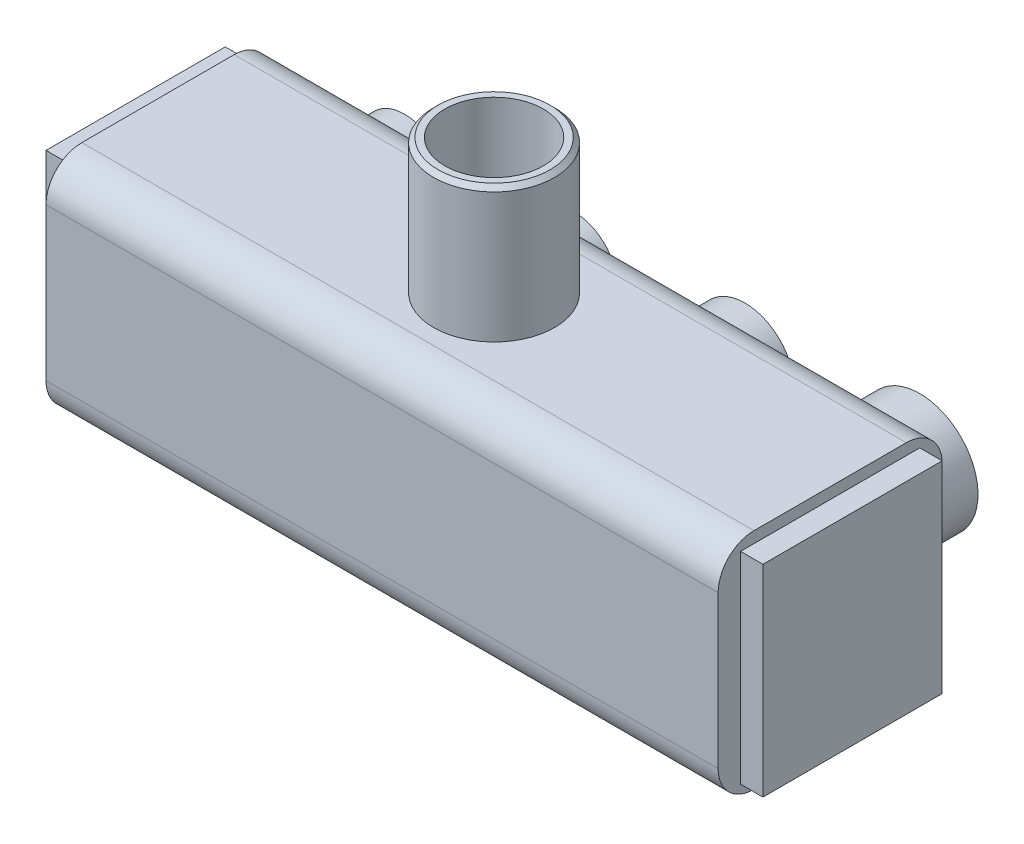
SolidWorks part; units mm, degrees
ref_plane "Plan de face" through (0, 0, 0) normal (0, 0, 1) x (1, 0, 0)
ref_plane "Plan de dessus" through (0, 0, 0) normal (0, 1, 0) x (1, 0, 0)
ref_plane "Plan de droite" through (0, 0, 0) normal (1, 0, 0) x (0, 0, -1)
sketch "Esquisse1" plane through (0, 0, 0) normal (0, 1, 0) x (1, 0, 0)
  line L0 (-75, 0) -> (75, 0)
  dimension "D1" = 150
other "Elément mécano-soudé1"
ref_plane "Plan1" through (-75, 0, 0) normal (1, 0, 0) x (0, 0, -1)
sketch "Sketch1" plane through (-75, 0, 0) normal (1, 0, 0) x (0, 0, -1)
  line L0 (-17, -20) -> (17, -20)
  line L1 (-20, -17) -> (-20, 17)
  line L2 (17, 20) -> (-17, 20)
  line L3 (20, 17) -> (20, -17)
  line L4 (-17, -25) -> (17, -25)
  line L5 (-25, -17) -> (-25, 17)
  line L6 (17, 25) -> (-17, 25)
  line L7 (25, 17) -> (25, -17)
  arc A0 (25, 17) -> (17, 25) centre (17, 17) ccw
  arc A1 (17, -25) -> (25, -17) centre (17, -17) ccw
  arc A2 (-25, -17) -> (-17, -25) centre (-17, -17) ccw
  arc A3 (-17, 25) -> (-25, 17) centre (-17, 17) ccw
  arc A4 (-17, 20) -> (-20, 17) centre (-17, 17) ccw
  arc A5 (20, 17) -> (17, 20) centre (17, 17) ccw
  arc A6 (17, -20) -> (20, -17) centre (17, -17) ccw
  arc A7 (-20, -17) -> (-17, -20) centre (-17, -17) ccw
  point P0 (-25, 0)
  point P1 (25, 0)
  point P2 (0, 25)
  point P3 (0, -25)
  point P4 (0, 0)
  point P5 (-25, -25)
  point P6 (25, -25)
  point P7 (25, 25)
  point P8 (-25, 25)
  point P33 (0, 0)
  dimension "D1" = 8
  dimension "Thickness" = 5
  dimension "V_leg" = 50
sketch "Esquisse3" plane through (75, 0, 0) normal (1, 0, 0) x (0, 0, -1)
  line L0 (0, 22.5) -> (0, -22.5)
  dimension "D1" = 45
other "Elément mécano-soudé2"
ref_plane "Plan2" through (75, 22.5, 0) normal (0, -1, 0) x (1, 0, 0)
sketch "Esquisse11" plane through (80, 22.5, -20) normal (0, -1, 0) x (0, 0, 1)
  line L0 (20, 5) -> (20, 0) construction
  line L1 (0, 0) -> (40, 0)
  line L2 (0, 0) -> (0, 5)
  line L3 (0, 5) -> (40, 5)
  line L4 (40, 0) -> (40, 5)
  line L5 (40, 2.5) -> (0, 2.5) construction
  point P9 (0, 0)
  dimension "D1" = 40
  dimension "D2" = 5
mirror "Symétrie1" about plane through (0, 0, 0) normal (1, 0, 0)
sketch "Esquisse12" plane through (0, 25, 0) normal (0, 1, 0) x (-1, 0, 0)
  circle A0 centre (0, 0) radius 13.25
  dimension "D1" = 26.5
extrude "Enlèv. mat.-Extru.1" cut sketch "Esquisse12" against normal up to next
sketch "Esquisse13" plane through (0, 0, -25) normal (0, 0, -1) x (-1, 0, 0)
  line L0 (75, 0) -> (-75, 0) construction
  line L1 (-75, 22.5) -> (-75, -22.5) construction
  circle A0 centre (-55, 0) radius 13.25
  dimension "D1" = 26.5
  dimension "D2" = 20
extrude "Enlèv. mat.-Extru.2" cut sketch "Esquisse13" against normal up to next
hole_wizard "Diamètre du perçage Ø22.5 (22.5)1" positions "Esquisse3D1" profile "Esquisse14" hole size "Ø22.5" standard "ISO"
sketch3d "Esquisse3D1"
  line L0 (16, 17, -25) -> (16, -17, -25) construction
  line L1 (75, 17, -25) -> (-75, 17, -25) construction
  line L2 (75, -17, -25) -> (-75, -17, -25) construction
  circle A0 centre (55, 0, -25) radius 13.25 construction
  point P0 (16, 0, -25)
  point P13 (55, 0, -38.25)
  dimension "D1" = 39
sketch "Esquisse14" plane through (16, 0, -25) normal (1, 0, 0) x (0, 1, 0)
  line L0 (0, 0) -> (0, 5)
  line L1 (0, 5) -> (11.25, 5)
  line L2 (11.25, 5) -> (11.25, 0)
  line L5 (11.25, 0) -> (0, 0)
  line L11 (0, -6.35) -> (0, 107.95) construction
  dimension "Diamètre du perçage jusqu'au prochain" = 22.5
  dimension "Profondeur du perçage jusqu'au prochain" = 5
hole_wizard "Diamètre du perçage Ø19.5 (19.5)1" positions "Esquisse3D2" profile "Esquisse16" hole size "Ø19.5" standard "ISO"
sketch3d "Esquisse3D2"
  line L0 (-22, 17, -25) -> (-22, -17, -25) construction
  line L1 (75, 17, -25) -> (-75, 17, -25) construction
  line L2 (75, -17, -25) -> (-75, -17, -25) construction
  line L4 (-60, 17, -25) -> (-60, -17, -25) construction
  line L6 (-75, -17, -25) -> (-75, 17, -25) construction
  point P2 (-60, 0, -25)
  point P17 (-22, 0, -25)
  dimension "D1" = 15
  dimension "D2" = 38
sketch "Esquisse16" plane through (-60, 0, -25) normal (1, 0, 0) x (0, 1, 0)
  line L0 (0, 0) -> (0, 5)
  line L1 (0, 5) -> (9.75, 5)
  line L2 (9.75, 5) -> (9.75, 0)
  line L5 (9.75, 0) -> (0, 0)
  line L11 (0, -6.35) -> (0, 107.95) construction
  dimension "Diamètre du perçage jusqu'au prochain" = 19.5
  dimension "Profondeur du perçage jusqu'au prochain" = 5
inserted part "bobine 3-4°"
move or copy body "Corps-Déplacer/Copier2" placed by mates yes
other "<bobine 3-4°>-<Chanfrein1>"
inserted part "manchon à souder 1-2°"
move or copy body "Corps-Déplacer/Copier4" placed by mates yes
other "Distance1" parameters "D1"=15
other "<manchon à souder 1-2°>-<Extrusion1>"
inserted part "manchon à souder 3-8°"
move or copy body "Corps-Déplacer/Copier6" placed by mates yes
other "<manchon à souder 3-8°>-<Extrusion1>"
inserted part "manchon à souder 1-4°"
move or copy body "Corps-Déplacer/Copier8" placed by mates yes
other "<manchon à souder 1-4°>-<Extrusion1>"
inserted part "manchon à souder 1-4°2"
move or copy body "Corps-Déplacer/Copier10" placed by mates yes
other "<manchon à souder 1-4°>-<Extrusion1>"
